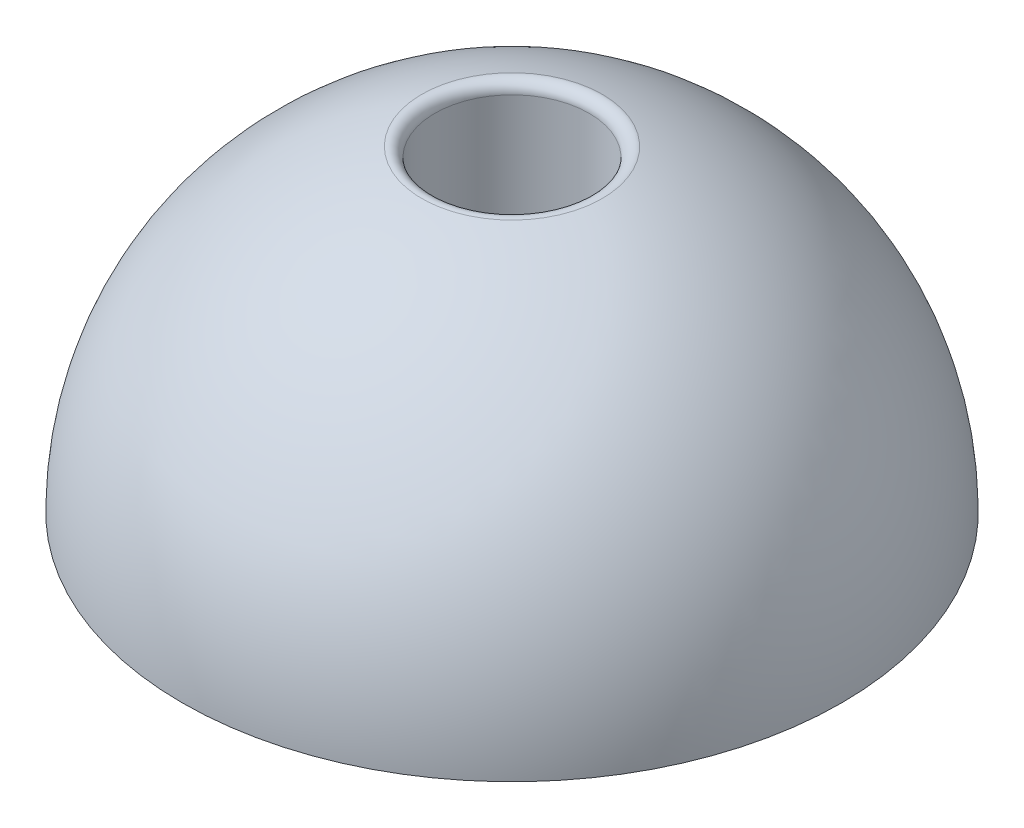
SolidWorks part; units mm, degrees
ref_plane "Front" through (0, 0, 0) normal (0, 0, 1) x (1, 0, 0)
ref_plane "Top" through (0, 0, 0) normal (0, 1, 0) x (1, 0, 0)
ref_plane "Right" through (0, 0, 0) normal (1, 0, 0) x (0, 0, -1)
sketch "Sketch1" plane through (0, 0, 0) normal (0, 0, 1) x (1, 0, 0)
  line L0 (0, 0) -> (0, -46.8792) construction
  line L1 (0, 0) -> (40.6911, 0)
  line L2 (0, 0) -> (0, 40.6911)
  arc A0 (40.6911, 0) -> (0, 40.6911) centre (0, 0) ccw
revolve "Revolve1" add sketch "Sketch1" angle 360 about L0
sketch "Sketch2" plane through (0, 0, 0) normal (0, -1, 0) x (1, 0, 0)
  line L3 (16.1696, -15.1011) -> (16.1696, 0)
  line L4 (21.2242, -15.1011) -> (21.2242, 0)
  dimension "D1" = 5.0546
sketch "Sketch3" plane through (0, 0, 0) normal (0, -1, 0) x (1, 0, 0)
  circle A0 centre (0, 0) radius 9.525
  dimension "D1" = 19.05
extrude "Cut-Extrude1" cut sketch "Sketch3" against normal through all
fillet "Fillet1" radius 1.27 1 edges at (0, 39.5606, -9.525)
